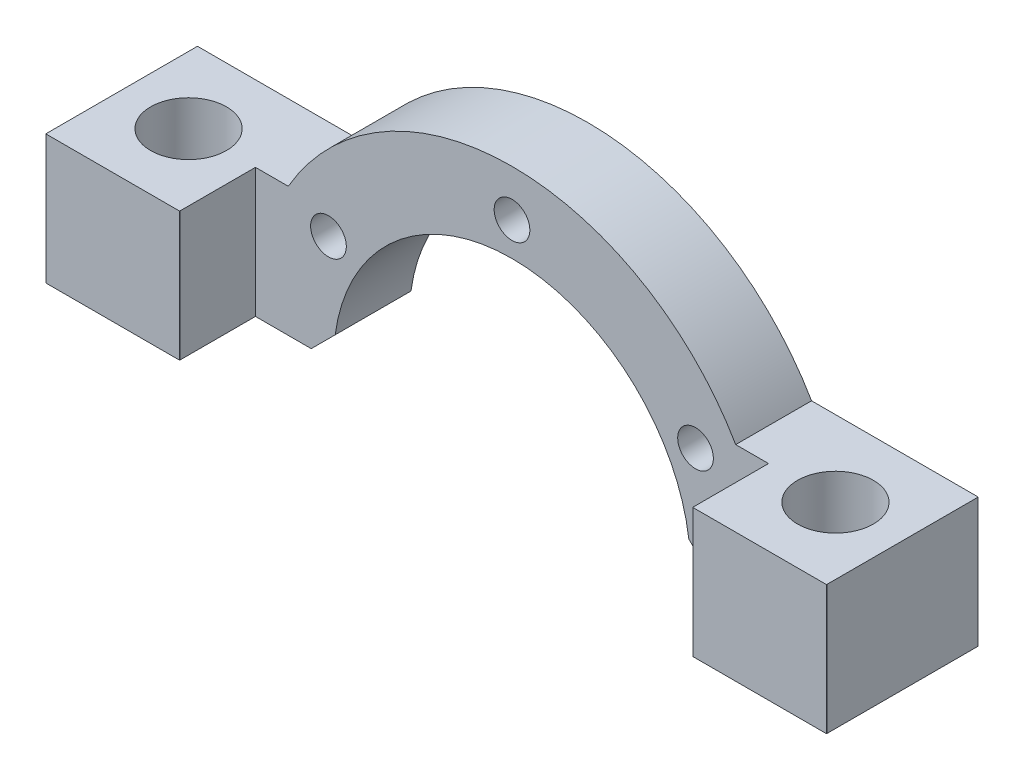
SolidWorks part; units mm, degrees
ref_plane "Front Plane" through (0, 0, 0) normal (0, 0, 1) x (1, 0, 0)
ref_plane "Top Plane" through (0, 0, 0) normal (0, 1, 0) x (1, 0, 0)
ref_plane "Right Plane" through (0, 0, 0) normal (1, 0, 0) x (0, 0, -1)
sketch "Sketch1" plane through (0, 0, 0) normal (0, 0, 1) x (1, 0, 0)
  line L0 (-8, 0) -> (-17.5, 0)
  line L1 (-17.5, 0) -> (-17.5, 11.58)
  line L2 (-17.5, 11.58) -> (17.5, 11.58)
  line L3 (17.5, 11.58) -> (17.5, 0)
  line L4 (17.5, 0) -> (8, 0)
  line L5 (0, 0) -> (0, 9.5) construction
  arc A0 (-8, 0) -> (8, 0) centre (0, 0) cw
  circle A1 centre (0, 0) radius 9.5 construction
  dimension "D1" = 8
  dimension "D2" = 9.5
  dimension "D3" = 9.5
  dimension "D4" = 9.5
  dimension "D5" = 11.58
extrude "Boss-Extrude1" add sketch "Sketch1" along normal blind 3.4
sketch "Sketch2" plane through (0, 0, 3.4) normal (0, 0, 1) x (1, 0, 0)
  line L0 (-17.5, 0) -> (-8, 0) construction
  line L1 (-17.5, 11.58) -> (-11.5, 11.58)
  line L2 (-17.5, 11.58) -> (-17.5, 0)
  line L3 (-17.5, 0) -> (-11.5, 0)
  line L4 (-11.5, 11.58) -> (-11.5, 0)
  line L5 (0, 0) -> (0, 11.58) construction
  line L6 (17.5, 11.58) -> (-17.5, 11.58) construction
  line L7 (17.5, 0) -> (11.5, 0)
  line L8 (17.5, 11.58) -> (17.5, 0)
  line L9 (17.5, 11.58) -> (11.5, 11.58)
  line L10 (11.5, 11.58) -> (11.5, 0)
  dimension "D1" = 6
extrude "Boss-Extrude2" add sketch "Sketch2" along normal blind 3.4
chamfer "Chamfer1" distance 0.01 angle 45 6 edges at (17.5, 5.79, 0) (17.5, 5.79, 6.8) (11.5, 5.79, 6.8) (-17.5, 5.79, 0) (-11.5, 5.79, 6.8) (-17.5, 5.79, 6.8)
sketch "Sketch3" plane through (0, 11.58, 0) normal (0, 1, 0) x (1, 0, 0)
  line L0 (-11.51, -6.8) -> (-17.49, -6.8) construction
  line L1 (0, 0) -> (0, -3.4) construction
  line L2 (11.5, -3.4) -> (-11.5, -3.4) construction
  circle A0 centre (-14.5, -3.4) radius 1.7
  circle A1 centre (14.5, -3.4) radius 1.7
  point P7 (-14.5, -6.8)
  dimension "D1" = 3.4
sketch "Sketch4" plane through (0, 0, 0) normal (0, 0, -1) x (-1, 0, 0)
  line L0 (0, 0) -> (0, 9.5) construction
  line L1 (0, 0) -> (8.2272, 4.75) construction
  line L2 (0, 0) -> (-8.2272, 4.75) construction
  dimension "D1" = 9.5
  dimension "D2" = 9.5
  dimension "D3" = 60
hole_wizard "M2x0.4 Tapped Hole1" positions "Sketch7" profile "Sketch8" tap size "M2x0.4" standard "ANSI Metric"
sketch "Sketch7" plane through (0, 0, 0) normal (0, 0, -1) x (-1, 0, 0)
  point P0 (-8.2272, 4.75)
  point P3 (0, 9.5)
  point P6 (8.2272, 4.75)
sketch "Sketch8" plane through (8.2272, 4.75, 0) normal (1, 0, 0) x (0, 1, 0)
  line L0 (0, 0) -> (0, 6.8)
  line L1 (0, 6.8) -> (0.8, 6.8)
  line L2 (0.8, 6.8) -> (0.8, 0)
  line L5 (0.8, 0) -> (0, 0)
  line L11 (0, -6.35) -> (0, 107.95) construction
  dimension "Thru Tap Drill Dia." = 1.6
  dimension "Thru Tap Drill Depth" = 6.8
sketch "Sketch11" plane through (0, 0, 3.4) normal (0, 0, 1) x (1, 0, 0)
  line L0 (11.5, 11.58) -> (-11.5, 11.58) construction
  line L1 (-17.5, 5.79) -> (-10.0286, 5.79)
  line L2 (-17.5, 0) -> (-17.5, 11.58) construction
  line L3 (17.5, 11.58) -> (17.5, 0) construction
  line L4 (10.0286, 5.79) -> (17.5, 5.79)
  line L5 (-17.5, 5.79) -> (-17.5, 11.58)
  line L6 (-17.5, 11.58) -> (17.5, 11.58)
  line L7 (17.5, 11.58) -> (17.5, 5.79)
  arc A0 (10.0286, 5.79) -> (-10.0286, 5.79) centre (0, 0) ccw
extrude "Cut-Extrude2" cut sketch "Sketch11" against normal through all both and the other way through all contours A0 L6 L1 M6 | L6 L5 L1 M6 | A0 L4 M4 M5 | L7 L6 L4 M4
chamfer "Chamfer2" distance 1 angle 45 2 edges at (8, 0, 1.7) (-8, 0, 1.7)
extrude "Cut-Extrude3" cut sketch "Sketch3" against normal through all
